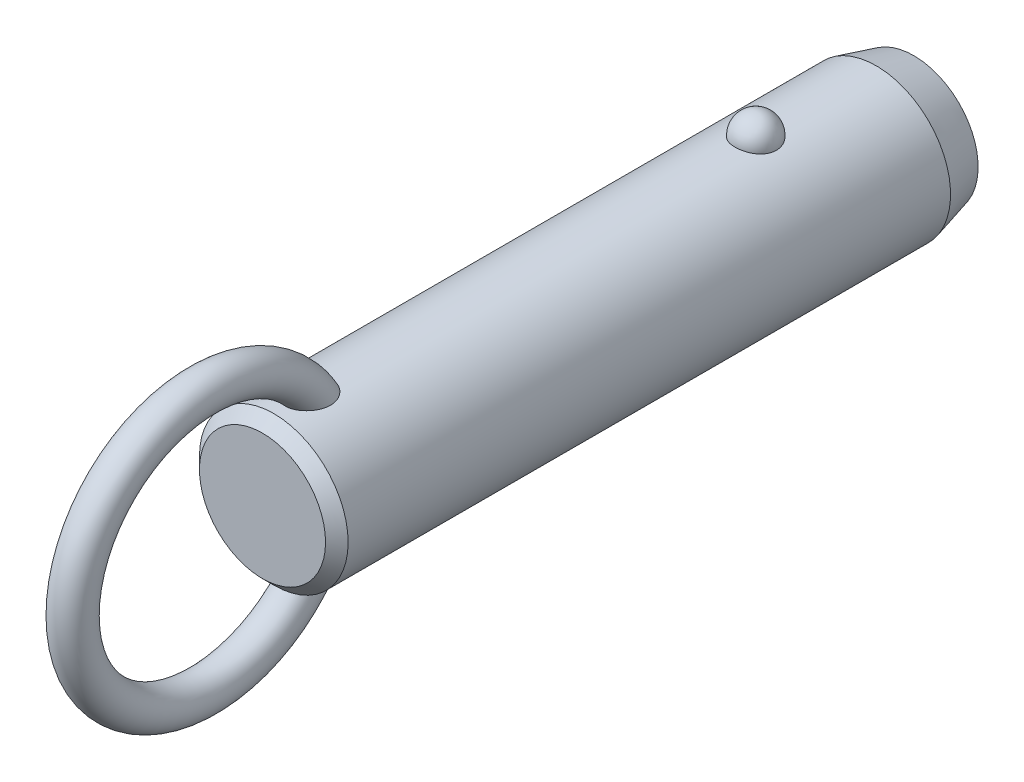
SolidWorks part; units mm, degrees
ref_plane "Front Plane" through (0, 0, 0) normal (0, 0, 1) x (1, 0, 0)
ref_plane "Top Plane" through (0, 0, 0) normal (0, 1, 0) x (1, 0, 0)
ref_plane "Right Plane" through (0, 0, 0) normal (1, 0, 0) x (0, 0, -1)
sketch "Sketch2" plane through (0, 0, 0) normal (0, 0, 1) x (1, 0, 0)
  circle A0 centre (0, 0) radius 7.9
  point P3 (0, 7.9)
  dimension "D1" = 15.8
extrude "Boss-Extrude1" add sketch "Sketch2" along normal blind 40.7
sketch "Sketch3" plane through (0, 0, 0) normal (0, 0, -1) x (-1, 0, 0)
  circle A0 centre (0, 0) radius 7.9
  dimension "D1" = 15.8
extrude "Boss-Extrude2" add sketch "Sketch3" along normal blind 19
chamfer "Chamfer1" distance 4 angle 15 1 edges at (-7.9, 0, -19)
sketch "Sketch12" plane through (0, 0, 0) normal (1, 0, 0) x (0, 0, -1)
  line L0 (-40.7, 7.9) -> (-40.7, -7.9) construction
  point P0 (-40.7, 0)
sketch "Sketch13" plane through (0, 0, 0) normal (1, 0, 0) x (0, 0, -1)
  circle A0 centre (-56.55, 0) radius 15.85
  point P2 (-40.7, 0)
  dimension "D1" = 31.7
sketch "Sketch14" plane through (0, 0, 0) normal (0, 1, 0) x (1, 0, 0)
  circle A0 centre (0, -42.7) radius 2
  point P2 (0, -40.7)
  dimension "D1" = 4
sweep "Sweep1" add profiles "Sketch14" path "Sketch13"
sketch "Sketch15" plane through (0, 0, 40.7) normal (0, 0, 1) x (1, 0, 0)
  circle A0 centre (0, 0) radius 7.9
  dimension "D1" = 15.8
extrude "Boss-Extrude3" add sketch "Sketch15" along normal blind 9.52
chamfer "Chamfer2" distance 1.2 angle 45 1 edges at (7.9, 0, 50.22)
sketch "Sketch18" plane through (0, 0, 0) normal (1, 0, 0) x (0, 0, -1)
  line L0 (15, 7.9) -> (-42.8091, 7.9) construction
  line L1 (2.2, 10.1) -> (2.2, 5.7)
  line L2 (-42.8091, -7.9) -> (15, -7.9) construction
  arc A0 (2.2, 10.1) -> (2.2, 5.7) centre (2.2, 7.9) ccw
  point P4 (0, 7.9)
  dimension "D1" = 18
revolve "Revolve1" add sketch "Sketch18" angle 360 about L1
